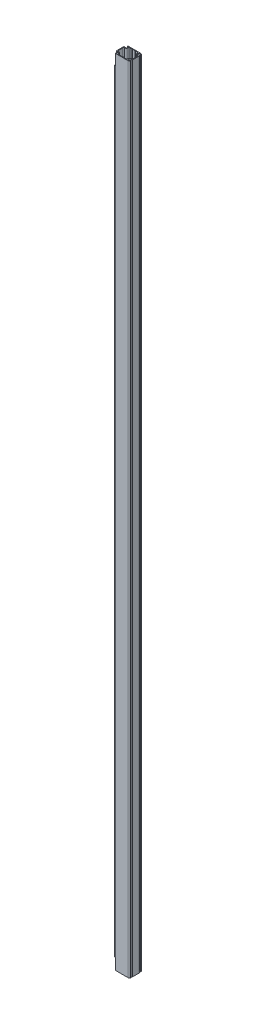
SolidWorks part; units mm, degrees
ref_plane "Alzado" through (0, 0, 0) normal (0, 0, 1) x (1, 0, 0)
ref_plane "Planta" through (0, 0, 0) normal (0, 1, 0) x (1, 0, 0)
ref_plane "Vista lateral" through (0, 0, 0) normal (1, 0, 0) x (0, 0, -1)
sketch "Croquis1" plane through (0, 0, 0) normal (0, 1, 0) x (1, 0, 0)
  line L0 (0, -75.4262) -> (0, 70.5479) construction
  line L1 (-123.9156, -11.6543) -> (129.4204, -11.6543) construction
  line L6 (39.5, 1.486) -> (39.5, 34.9397) construction
  line L7 (19.5039, 17.8457) -> (63.5704, 17.8457) construction
  line L9 (46, -42.8837) -> (46, -42.6992)
  line L10 (22.5, 24.3457) -> (12.5, 24.3457)
  line L12 (39.5, 17.8457) -> (50.0765, 20.3595) construction
  line L13 (47.3463, 21.5924) -> (48.0388, 18.6787) construction
  line L14 (47.3463, -44.9011) -> (48.0388, -41.9874) construction
  line L15 (39.5, -41.1543) -> (50.0765, -43.6682) construction
  line L16 (19.5039, -41.1543) -> (63.5704, -41.1543) construction
  line L17 (39.5, -24.7947) -> (39.5, -58.2483) construction
  line L19 (46, 19.5751) -> (46, 19.3906)
  line L20 (39.5, -51.6543) -> (-39.5, -51.6543)
  line L21 (11, 22.8457) -> (12.5, 24.3457)
  line L22 (46, -24.1543) -> (46, 0.8457)
  line L23 (50, -31.9348) -> (50, 8.6261)
  line L24 (-39.5, -24.7947) -> (-39.5, -58.2483) construction
  line L25 (-19.5039, -41.1543) -> (-63.5704, -41.1543) construction
  line L26 (-39.5, -41.1543) -> (-50.0765, -43.6682) construction
  line L27 (-47.3463, -44.9011) -> (-48.0388, -41.9874) construction
  line L28 (-47.3463, 21.5924) -> (-48.0388, 18.6787) construction
  line L29 (-39.5, 17.8457) -> (-50.0765, 20.3595) construction
  line L30 (-19.5039, 17.8457) -> (-63.5704, 17.8457) construction
  line L31 (-39.5, 1.486) -> (-39.5, 34.9397) construction
  line L32 (123.9156, -11.6543) -> (-129.4204, -11.6543) construction
  line L33 (-50, -31.9348) -> (-50, 8.6261)
  line L34 (-46, -24.1543) -> (-46, 0.8457)
  line L35 (-50, 28.3457) -> (-50, -31.9348)
  line L36 (-39.5, -51.6543) -> (39.5, -51.6543)
  line L38 (-22.5, -47.6543) -> (-12.5, -47.6543)
  line L39 (-22.5, 24.3457) -> (-12.5, 24.3457)
  line L40 (-46, -42.8837) -> (-46, -42.6992)
  line L41 (-39.5, 28.3457) -> (39.5, 28.3457)
  line L42 (46, 0.8457) -> (46, -24.1543)
  line L43 (50, 8.6261) -> (50, -31.9348)
  line L44 (8, 22.8457) -> (6.5, 24.3457)
  line L45 (11, 22.8457) -> (8, 22.8457)
  line L46 (-11, 22.8457) -> (-8, 22.8457)
  line L47 (-8, 22.8457) -> (-6.5, 24.3457)
  line L48 (-11, 22.8457) -> (-12.5, 24.3457)
  line L49 (11, -46.1543) -> (8, -46.1543)
  line L50 (8, -46.1543) -> (6.5, -47.6543)
  line L51 (11, -46.1543) -> (12.5, -47.6543)
  line L52 (-11, -46.1543) -> (-12.5, -47.6543)
  line L53 (-8, -46.1543) -> (-6.5, -47.6543)
  line L54 (-11, -46.1543) -> (-8, -46.1543)
  line L55 (-6.5, -47.6543) -> (6.5, -47.6543)
  line L56 (12.5, -47.6543) -> (22.5, -47.6543)
  line L57 (-12.5, 24.3457) -> (-22.5, 24.3457)
  line L58 (6.5, 24.3457) -> (-6.5, 24.3457)
  line L59 (-6.5, 24.3457) -> (6.5, 24.3457)
  line L60 (12.5, 24.3457) -> (22.5, 24.3457)
  line L61 (-46, 0.8457) -> (-46, -24.1543)
  arc A0 (49.242, 21.7627) -> (39.5, 28.3457) centre (39.5, 17.8457) ccw
  arc A1 (45.5308, 20.2705) -> (43.0455, 12.3978) centre (39.5, 17.8457) ccw
  arc A5 (45.5308, 20.2705) -> (49.242, 21.7627) centre (47.3864, 21.0166) ccw
  arc A6 (29, 17.8457) -> (22.5, 24.3457) centre (22.5, 17.8457) ccw
  arc A7 (46, 0.8457) -> (39.5, 7.3457) centre (39.5, 0.8457) ccw
  arc A9 (50, 8.6261) -> (43.0455, 12.3978) centre (45.5, 8.6261) ccw
  arc A10 (50, -31.9348) -> (43.0455, -35.7064) centre (45.5, -31.9348) cw
  arc A11 (46, -24.1543) -> (39.5, -30.6543) centre (39.5, -24.1543) cw
  arc A12 (29, -41.1543) -> (22.5, -47.6543) centre (22.5, -41.1543) cw
  arc A13 (45.5308, -43.5791) -> (49.242, -45.0713) centre (47.3864, -44.3252) cw
  arc A14 (45.5308, -43.5791) -> (43.0455, -35.7064) centre (39.5, -41.1543) cw
  arc A15 (49.242, -45.0713) -> (39.5, -51.6543) centre (39.5, -41.1543) cw
  arc A16 (29, -41.1543) -> (39.5, -30.6543) centre (39.5, -41.1543) cw
  arc A17 (29, 17.8457) -> (39.5, 7.3457) centre (39.5, 17.8457) ccw
  arc A18 (-29, 17.8457) -> (-39.5, 7.3457) centre (-39.5, 17.8457) cw
  arc A19 (-29, -41.1543) -> (-39.5, -30.6543) centre (-39.5, -41.1543) ccw
  arc A20 (-49.242, -45.0713) -> (-39.5, -51.6543) centre (-39.5, -41.1543) ccw
  arc A21 (-45.5308, -43.5791) -> (-43.0455, -35.7064) centre (-39.5, -41.1543) ccw
  arc A22 (-45.5308, -43.5791) -> (-49.242, -45.0713) centre (-47.3864, -44.3252) ccw
  arc A23 (-29, -41.1543) -> (-22.5, -47.6543) centre (-22.5, -41.1543) ccw
  arc A24 (-46, -24.1543) -> (-39.5, -30.6543) centre (-39.5, -24.1543) ccw
  arc A25 (-50, -31.9348) -> (-43.0455, -35.7064) centre (-45.5, -31.9348) ccw
  arc A26 (-50, 8.6261) -> (-43.0455, 12.3978) centre (-45.5, 8.6261) cw
  arc A27 (-46, 0.8457) -> (-39.5, 7.3457) centre (-39.5, 0.8457) cw
  arc A28 (-29, 17.8457) -> (-22.5, 24.3457) centre (-22.5, 17.8457) cw
  arc A29 (-45.5308, 20.2705) -> (-49.242, 21.7627) centre (-47.3864, 21.0166) cw
  arc A30 (-45.5308, 20.2705) -> (-43.0455, 12.3978) centre (-39.5, 17.8457) cw
  arc A31 (-49.242, 21.7627) -> (-39.5, 28.3457) centre (-39.5, 17.8457) cw
  dimension "D8" = 2
  dimension "D9" = 13
  dimension "D12" = 4.5
  dimension "D2" = 8
  dimension "D3" = 11.6543
  dimension "D4" = 3
  dimension "D5" = 45
  dimension "D6" = 45
  dimension "D10" = 13.37
  dimension "D11" = 8.5
  dimension "D13" = 3.1709
  dimension "D14" = 9.2195
extrude "Saliente-Extruir1" add sketch "Croquis1" along normal blind 5000 contours A31 A29 A30 A26 L33 A25 A21 A22 A20 L20 A15 A13 A14 A10 L23 A9 A1 A5 A0 L41 A18 A28 L39 L48 L46 L47 L58 L44 L45 L21 L10 A6 A17 A7 L22 A11 A16 A12 L56 L51 L49 L50 L55 L53 L54 L52 L38
sketch "Croquis2" plane through (0, 5000, 0) normal (0, 1, 0) x (1, 0, 0)
  line L0 (-39.5, 17.8457) -> (-39.5, 28.3457)
  line L1 (-39.5, 28.3457) -> (-54.234, 28.3457)
  line L2 (-54.234, 28.3457) -> (-54.234, 17.8457)
  line L3 (-54.234, 17.8457) -> (-39.5, 17.8457)
  line L4 (0, 0) -> (0, -28.1071) construction
  line L5 (-50, -11.6543) -> (50, -11.6543) construction
  line L6 (-50, -31.9348) -> (-50, 8.6261) construction
  line L7 (50, -31.9348) -> (50, 8.6261) construction
  line L8 (-39.5, -41.1543) -> (-39.5, -51.6543)
  line L9 (-54.234, -41.1543) -> (-39.5, -41.1543)
  line L10 (-54.234, -51.6543) -> (-54.234, -41.1543)
  line L11 (-39.5, -51.6543) -> (-54.234, -51.6543)
extrude "Cortar-Extruir1" cut sketch "Croquis2" against normal blind 70
sketch "Croquis3" plane through (0, 0, 0) normal (0, -1, 0) x (1, 0, 0)
  line L0 (-39.5, 41.1543) -> (-39.5, 51.6543)
  line L1 (-39.5, 51.6543) -> (-52.8489, 51.6543)
  line L2 (-52.8489, 51.6543) -> (-52.8489, 41.1543)
  line L3 (-52.8489, 41.1543) -> (-39.5, 41.1543)
  line L4 (-50, 11.6543) -> (8.1629, 11.6543) construction
  line L5 (-50, 31.9348) -> (-50, -8.6261) construction
  line L6 (-39.5, -28.3457) -> (-52.8489, -28.3457)
  line L7 (-52.8489, -28.3457) -> (-52.8489, -17.8457)
  line L8 (-52.8489, -17.8457) -> (-39.5, -17.8457)
  line L9 (-39.5, -17.8457) -> (-39.5, -28.3457)
extrude "Cortar-Extruir2" cut sketch "Croquis3" against normal blind 70
